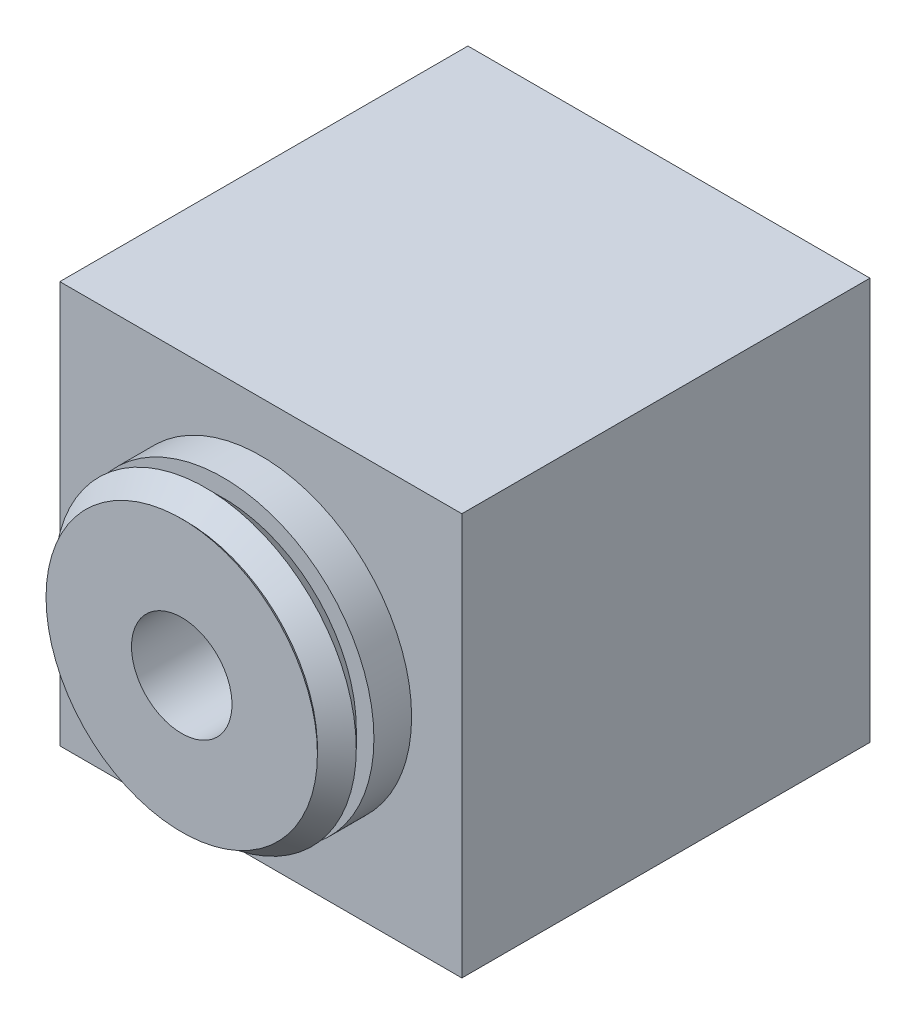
SolidWorks part; units mm, degrees
ref_plane "Front" through (0, 0, 0) normal (0, 0, 1) x (1, 0, 0)
ref_plane "Top" through (0, 0, 0) normal (0, 1, 0) x (1, 0, 0)
ref_plane "Right" through (0, 0, 0) normal (1, 0, 0) x (0, 0, -1)
ref_plane "Body Plane" through (0, 0, -3.9982) normal (0, 0, 1) x (1, 0, 0)
sketch "Sketch1" plane through (0, 0, 0) normal (1, 0, 0) x (0, 0, -1)
  line L0 (71.2941, 0) -> (-67.6458, 0) construction
  line L1 (0, 0) -> (0, 6.858)
  line L2 (0, 6.858) -> (0.2197, 6.6383)
  line L3 (0.2197, 6.6383) -> (1.2014, 7.62)
  line L4 (1.2014, 7.62) -> (2.0932, 6.7282)
  line L5 (2.0932, 6.7282) -> (2.0932, 7.62)
  line L6 (2.0932, 7.62) -> (3.9982, 7.62)
  line L7 (3.9982, 7.62) -> (3.9982, 0)
  line L8 (3.9982, 0) -> (0, 0)
  dimension "D1" = 45
  dimension "D2" = 7.62
  dimension "D3" = 7.62
  dimension "D4" = 0.8918
  dimension "D5" = 1.2014
  dimension "D6" = 6.858
  dimension "Front Length" = 1.905
revolve "Base" add sketch "Sketch1" angle 360 about L0
sketch "Sketch9" plane through (0, 0, -3.9982) normal (0, 0, -1) x (-1, 0, 0)
  line L1 (-10.16, 10.16) -> (10.16, 10.16)
  line L2 (-10.16, 10.16) -> (-10.16, -10.16)
  line L3 (-10.16, -10.16) -> (10.16, -10.16)
  line L4 (10.16, 10.16) -> (10.16, -10.16)
  point P4 (0, 10.16)
  point P5 (10.16, 0)
  dimension "D1" = 20.32
  dimension "D2" = 20.32
extrude "F Body" add sketch "Sketch9" along normal blind 20.6248
sketch "Sketch11" plane through (0, 0, -24.623) normal (0, 0, -1) x (-1, 0, 0)
  line L0 (-10.16, 10.16) -> (10.16, -10.16) construction
  circle A0 centre (6.9195, 6.5509) radius 1.7272
  circle A1 centre (-6.5509, -6.9195) radius 1.7272
  dimension "D1" = 3.4544
  dimension "D2" = 19.05
extrude "F Mounting Holes" cut sketch "Sketch11" against normal blind 7.9248
sketch "Sketch14" plane through (-10.16, 0, 0) normal (-1, 0, 0) x (0, 0, 1)
  line L0 (-24.623, -10.16) -> (-24.623, 10.16) construction
  circle A0 centre (-7.1732, 5.5499) radius 1.7272
  circle A1 centre (-18.273, -5.5499) radius 1.7272
  dimension "D1" = 3.4544
  dimension "D2" = 3.4544
  dimension "D3" = 6.35
  dimension "D4" = 11.0998
  dimension "D5" = 5.5499
  dimension "D6" = 5.5499
extrude "FSR Mounting Holes" cut sketch "Sketch14" against normal blind 4.7498
sketch "Sketch10" plane through (0, 0, -24.623) normal (0, 0, -1) x (-1, 0, 0)
  circle A0 centre (0, 0) radius 6.35
  dimension "D1" = 12.7
extrude "F Body 2" add sketch "Sketch10" along normal blind 1.5748
sketch "Sketch3" plane through (0, 0, 0) normal (0, 0, -1) x (-1, 0, 0)
  circle A0 centre (0, 0) radius 2.54
  dimension "D1" = 5.08
extrude "Hole Cut" cut sketch "Sketch3" along normal through all
